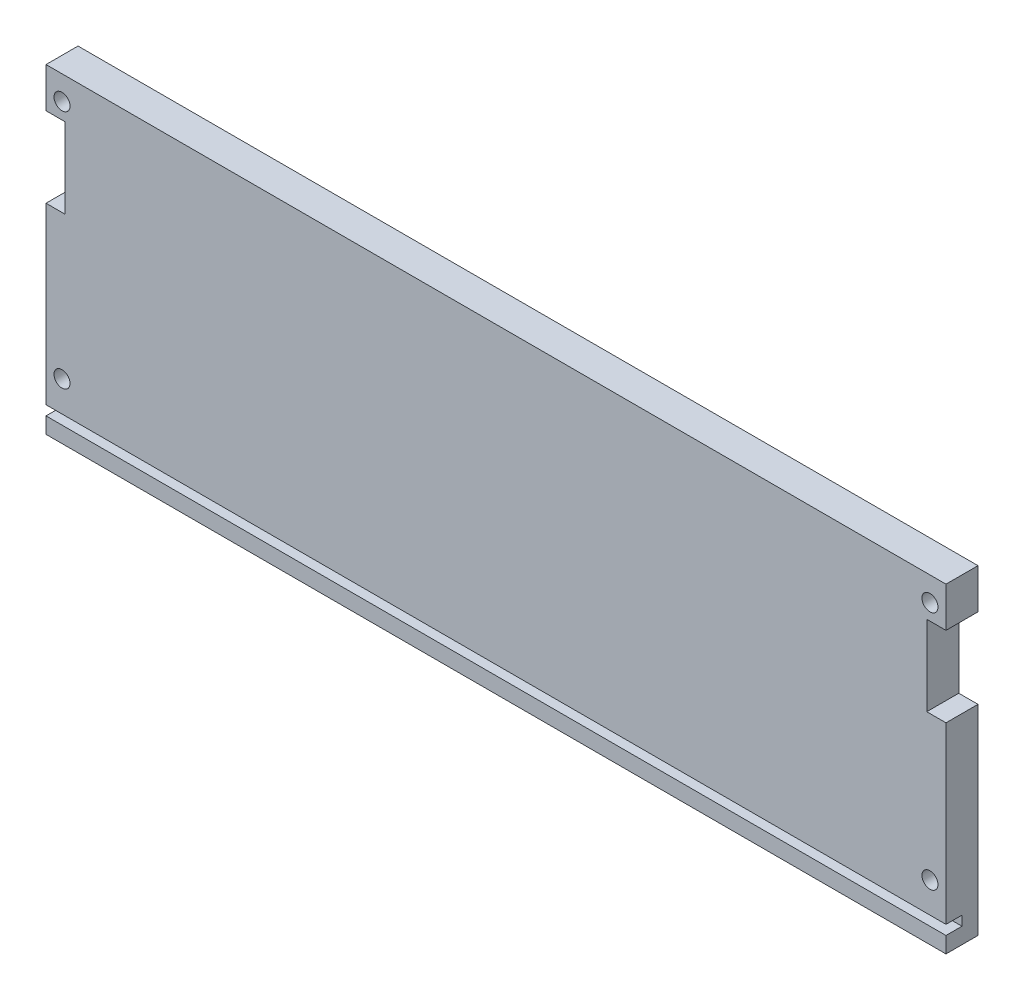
SolidWorks part; units mm, degrees
ref_plane "Front Plane" through (0, 0, 0) normal (0, 0, 1) x (1, 0, 0)
ref_plane "Top Plane" through (0, 0, 0) normal (0, 1, 0) x (1, 0, 0)
ref_plane "Right Plane" through (0, 0, 0) normal (1, 0, 0) x (0, 0, -1)
sketch "Sketch1" plane through (0, 0, 0) normal (0, 0, 1) x (1, 0, 0)
  line L1 (-140.5, -50) -> (140.5, -50)
  line L2 (-140.5, -50) -> (-140.5, 50)
  line L3 (-140.5, 50) -> (140.5, 50)
  line L4 (140.5, -50) -> (140.5, 50)
  line L5 (-140.5, -50) -> (140.5, 50) construction
  line L6 (-140.5, 50) -> (140.5, -50) construction
  point P0 (0, 0)
  dimension "D1" = 281
  dimension "D2" = 100
extrude "Boss-Extrude1" add sketch "Sketch1" along normal blind 10
sketch "Sketch2" plane through (0, 0, 10) normal (0, 0, 1) x (1, 0, 0)
  line L0 (0, 0) -> (0, 95.9638) construction
  line L1 (-140.5, -50) -> (140.5, -50) construction
  line L2 (-96.3808, 5) -> (-39.7201, 5) construction
  circle A0 centre (-135.5, -32.5) radius 2.5
  circle A1 centre (135.5, -32.5) radius 2.5
  circle A2 centre (135.5, 42.5) radius 2.5
  circle A3 centre (-135.5, 42.5) radius 2.5
  dimension "D2" = 271
  dimension "D3" = 5
  dimension "D1" = 17.5
  dimension "D4" = 75
extrude "Cut-Extrude1" cut sketch "Sketch2" against normal blind 5
sketch "Sketch4" plane through (0, 0, 0) normal (0, 0, -1) x (-1, 0, 0)
  line L0 (-140.5, -50) -> (-140.5, 50) construction
  line L1 (-140.5, 37.5) -> (-134.5, 37.5)
  line L2 (-140.5, 37.5) -> (-140.5, 12.5)
  line L3 (-140.5, 12.5) -> (-134.5, 12.5)
  line L4 (-134.5, 37.5) -> (-134.5, 12.5)
  line L5 (-140.5, 50) -> (140.5, 50) construction
  line L6 (0, 0) -> (0, 121.0517) construction
  line L7 (134.5, 37.5) -> (134.5, 12.5)
  line L8 (140.5, 12.5) -> (134.5, 12.5)
  line L9 (140.5, 37.5) -> (140.5, 12.5)
  line L10 (140.5, 37.5) -> (134.5, 37.5)
  dimension "D1" = 6
  dimension "D2" = 25
  dimension "D3" = 12.5
extrude "Cut-Extrude2" cut sketch "Sketch4" against normal through all
sketch "Sketch5" plane through (0, 0, 10) normal (0, 0, 1) x (1, 0, 0)
  line L0 (-140.5, 12.5) -> (-140.5, -50) construction
  line L1 (-140.5, -42) -> (140.5, -42)
  line L2 (-140.5, -42) -> (-140.5, -45)
  line L3 (-140.5, -45) -> (140.5, -45)
  line L4 (140.5, -42) -> (140.5, -45)
  line L5 (140.5, -50) -> (140.5, 12.5) construction
  line L6 (-140.5, -50) -> (140.5, -50) construction
  dimension "D1" = 3
  dimension "D2" = 5
extrude "Cut-Extrude3" cut sketch "Sketch5" against normal blind 5
